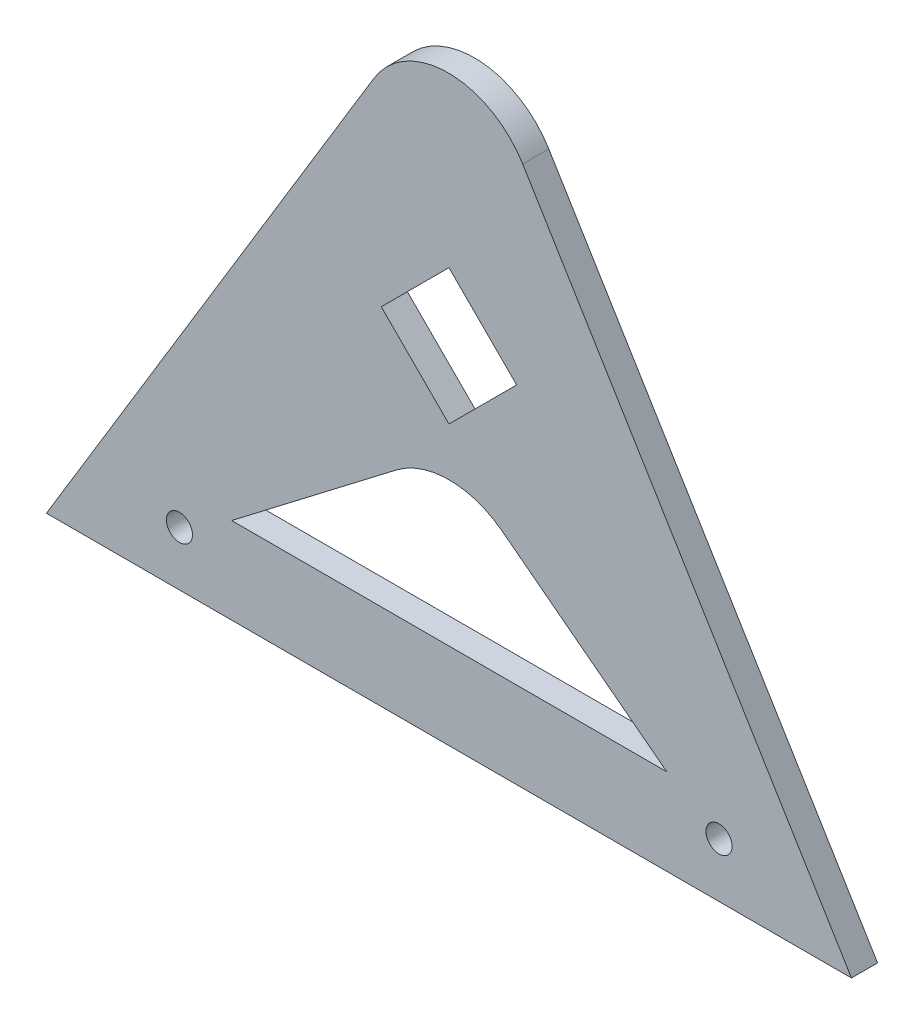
SolidWorks part; units mm, degrees
ref_plane "Plan de face" through (0, 0, 0) normal (0, 0, 1) x (1, 0, 0)
ref_plane "Plan de dessus" through (0, 0, 0) normal (0, 1, 0) x (1, 0, 0)
ref_plane "Plan de droite" through (0, 0, 0) normal (1, 0, 0) x (0, 0, -1)
sketch "Esquisse1" plane through (0, 0, 0) normal (0, 0, 1) x (1, 0, 0)
  line L0 (46.1151, 2.2462) -> (8.3394, 64.3529)
  line L1 (-46.3849, 2.2462) -> (46.1151, 2.2462)
  line L2 (-6.1802, 26.6476) -> (-25.1008, 12.1604)
  line L3 (-25.1008, 12.1604) -> (24.8992, 12.1604)
  line L4 (24.8992, 12.1604) -> (5.9786, 26.6476)
  line L5 (-0.1349, -29.7538) -> (-0.1349, 94.4719) construction
  line L6 (46.1151, 2.2462) -> (-0.1349, 78.2853) construction
  line L7 (-46.3849, 2.2462) -> (-0.1349, 78.2853) construction
  line L8 (-0.1349, 34.2462) -> (-0.1349, -29.7538) construction
  line L9 (-46.3849, 2.2462) -> (-8.7565, 64.3389)
  line L10 (-0.1349, 49.8026) -> (7.6433, 42.0244)
  line L11 (-0.1349, 49.8026) -> (-7.913, 42.0244)
  line L12 (7.6433, 42.0244) -> (-0.1349, 34.2462)
  line L13 (-7.913, 42.0244) -> (-0.1349, 34.2462)
  circle A0 centre (-31.1008, 8.4815) radius 1.5
  circle A1 centre (30.8992, 8.4815) radius 1.5
  arc A2 (8.3394, 64.3529) -> (-8.7565, 64.3389) centre (-0.2043, 59.1563) ccw
  arc A3 (5.9786, 26.6476) -> (-6.1802, 26.6476) centre (-0.1008, 18.7078) ccw
  point P11 (-0.1349, 2.2462)
  dimension "D3" = 10
  dimension "D4" = 10
  dimension "D11" = 3
  dimension "D1" = 11
  dimension "D2" = 11
  dimension "D5" = 92.5
  dimension "D6" = 32
  dimension "D7" = 47.5563
  dimension "D8" = 89
  dimension "D9" = 6.2352
  dimension "D10" = 15.2159
extrude "Extrusion1" add sketch "Esquisse1" along normal blind 3
